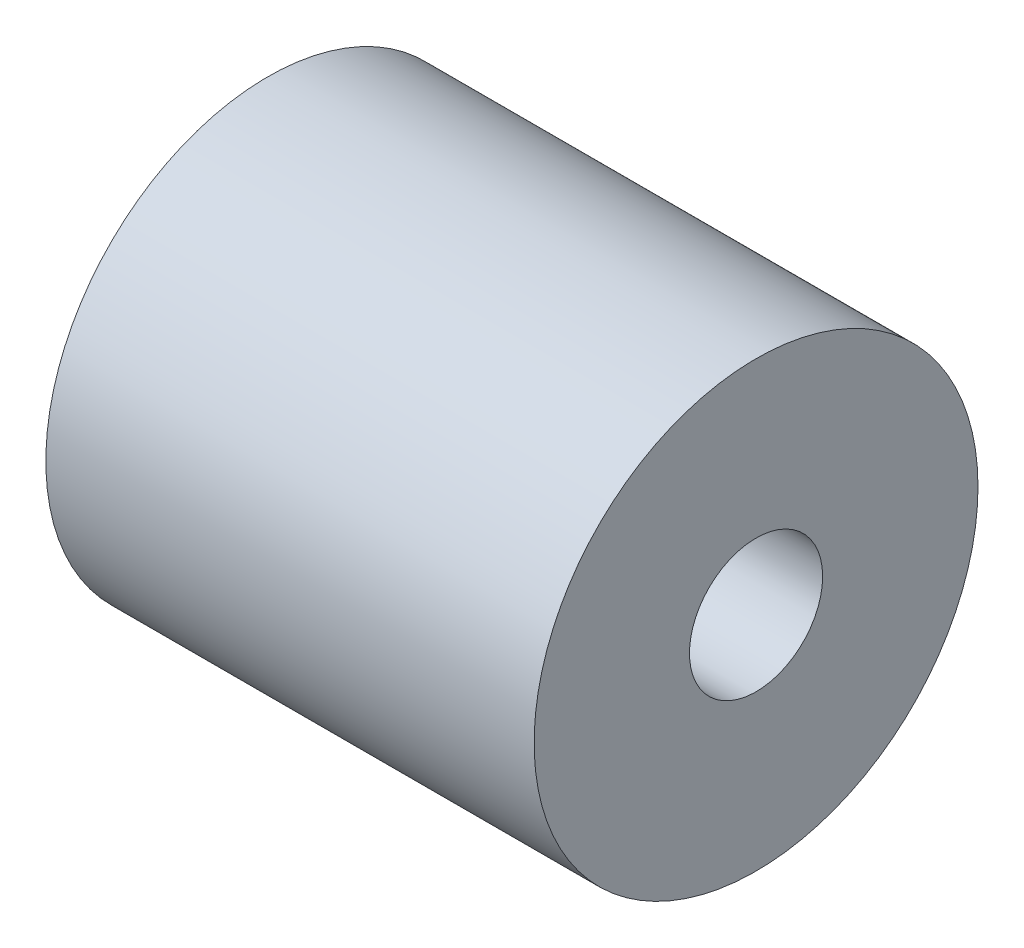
SolidWorks part; units mm, degrees
ref_plane "Front Plane" through (0, 0, 0) normal (0, 0, 1) x (1, 0, 0)
ref_plane "Top Plane" through (0, 0, 0) normal (0, 1, 0) x (1, 0, 0)
ref_plane "Right Plane" through (0, 0, 0) normal (1, 0, 0) x (0, 0, -1)
sketch "Sketch1" plane through (0, 0, 0) normal (1, 0, 0) x (0, 0, -1)
  circle A0 centre (0, 0) radius 6.35
  circle A1 centre (0, 0) radius 1.905
  dimension "D1" = 12.7
  dimension "D2" = 3.81
extrude "Boss-Extrude1" add sketch "Sketch1" along normal blind 13.97
